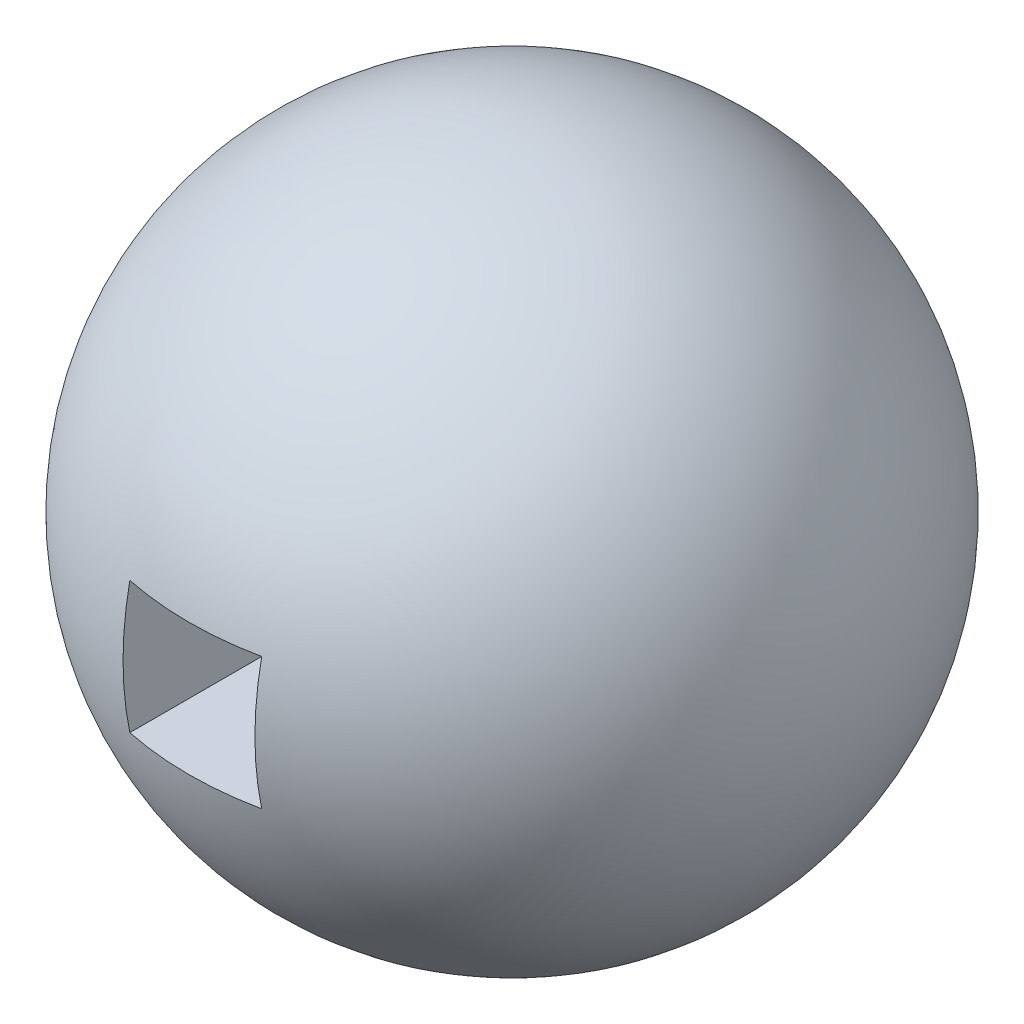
SolidWorks part; units mm, degrees
ref_plane "Front Plane" through (0, 0, 0) normal (0, 0, 1) x (1, 0, 0)
ref_plane "Top Plane" through (0, 0, 0) normal (0, 1, 0) x (1, 0, 0)
ref_plane "Right Plane" through (0, 0, 0) normal (1, 0, 0) x (0, 0, -1)
sketch "Sketch1" plane through (0, 0, 0) normal (0, 0, 1) x (1, 0, 0)
  line L0 (0, 2.5) -> (0, -2.5)
  arc A0 (0, 2.5) -> (0, -2.5) centre (0, 0) ccw
  dimension "D1" = 2.5
revolve "Revolve1" add sketch "Sketch1" angle 360 about L0
sketch "Sketch2" plane through (0, 0, 0) normal (0, 0, 1) x (1, 0, 0)
  line L1 (-0.5, -0.5) -> (0.5, -0.5)
  line L2 (-0.5, -0.5) -> (-0.5, 0.5)
  line L3 (-0.5, 0.5) -> (0.5, 0.5)
  line L4 (0.5, -0.5) -> (0.5, 0.5)
  line L5 (-0.5, -0.5) -> (0.5, 0.5) construction
  line L6 (-0.5, 0.5) -> (0.5, -0.5) construction
  point P0 (0, 0)
  dimension "D1" = 1
extrude "Cut-Extrude1" cut sketch "Sketch2" against normal up to surface and the other way up to surface
